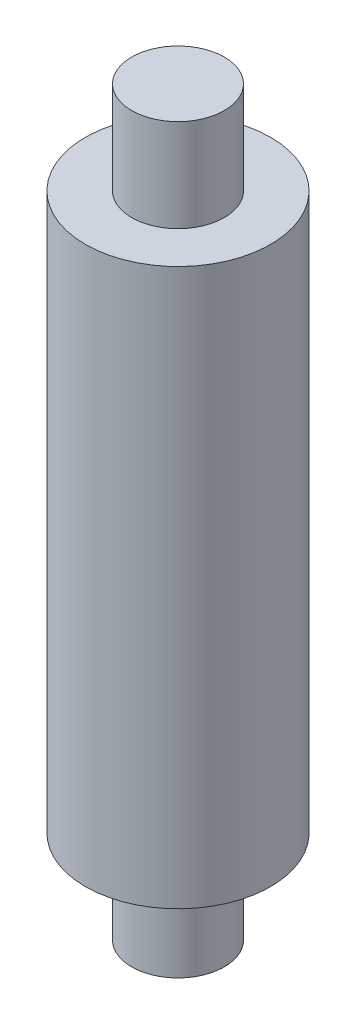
SolidWorks part; units mm, degrees
ref_plane "Front Plane" through (0, 0, 0) normal (0, 0, 1) x (1, 0, 0)
ref_plane "Top Plane" through (0, 0, 0) normal (0, 1, 0) x (1, 0, 0)
ref_plane "Right Plane" through (0, 0, 0) normal (1, 0, 0) x (0, 0, -1)
sketch "Sketch1" plane through (0, 0, 0) normal (0, 0, 1) x (1, 0, 0)
  line L0 (0, 0) -> (0, 800) construction
  line L1 (0, 800) -> (50, 800)
  line L2 (50, 800) -> (50, 700)
  line L3 (50, 700) -> (100, 700)
  line L4 (100, 700) -> (100, 100)
  line L5 (100, 100) -> (50, 100)
  line L6 (50, 100) -> (50, 0)
  line L7 (50, 0) -> (0, 0)
  line L8 (0, 0) -> (0, 800)
  dimension "D1" = 800
  dimension "D2" = 50
  dimension "D3" = 100
  dimension "D4" = 200
revolve "Revolve1" add sketch "Sketch1" angle 360 about L0
